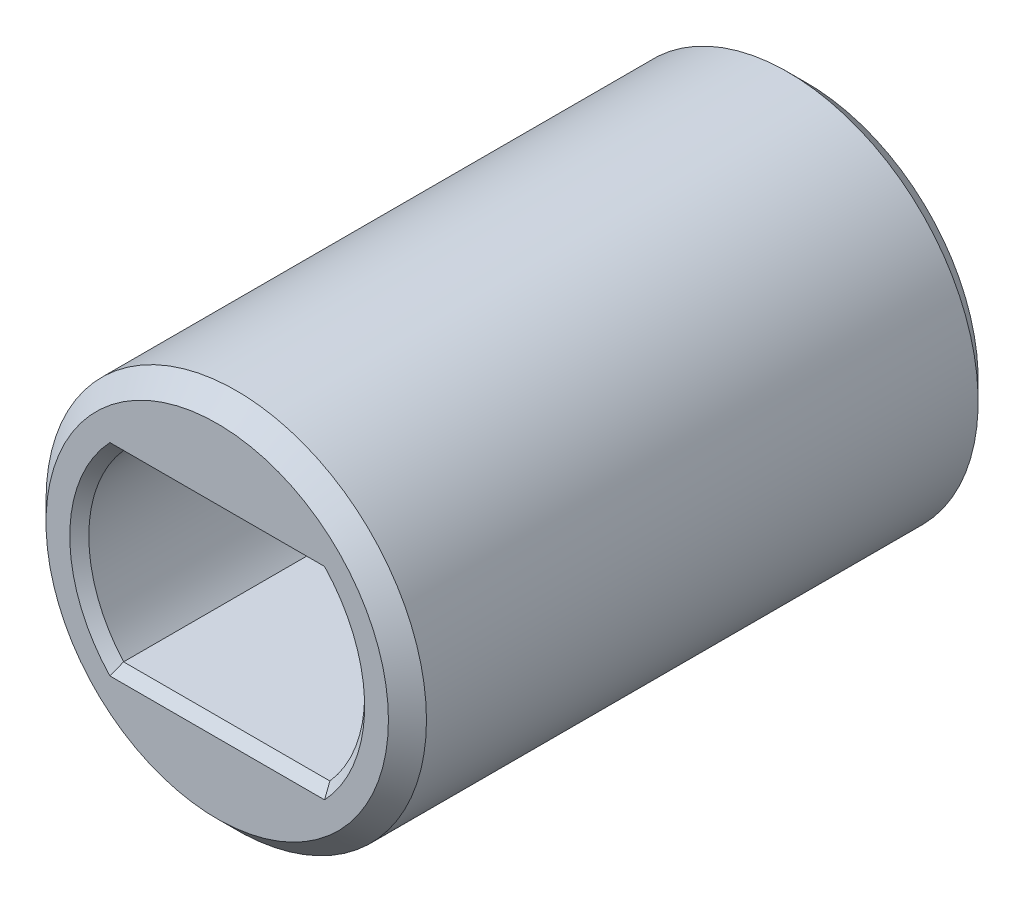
SolidWorks part; units mm, degrees
ref_plane "Přední rovina" through (0, 0, 0) normal (0, 0, 1) x (1, 0, 0)
ref_plane "Horní rovina" through (0, 0, 0) normal (0, 1, 0) x (1, 0, 0)
ref_plane "Pravá rovina" through (0, 0, 0) normal (1, 0, 0) x (0, 0, -1)
sketch "Skica1" plane through (0, 0, 0) normal (0, 0, 1) x (1, 0, 0)
  line L0 (-5.0761, 0) -> (4.8847, 0) construction
  line L1 (-2.169, 1.925) -> (2.169, 1.925)
  line L2 (-2.169, -1.925) -> (2.169, -1.925)
  line L3 (-5.9628, 5.3333) -> (-1.4907, 10.3333) construction
  line L4 (0, 4.24) -> (0, -1.5529) construction
  line L5 (5.9628, 5.3333) -> (1.4907, 10.3333) construction
  arc A0 (-2.169, 1.925) -> (-2.169, -1.925) centre (0, 0) ccw
  arc A1 (2.169, -1.925) -> (2.169, 1.925) centre (0, 0) ccw
  arc A2 (-5.9628, 5.3333) -> (5.9628, 5.3333) centre (0, 0) ccw construction
  arc A3 (1.4907, 10.3333) -> (-1.4907, 10.3333) centre (0, 9) ccw construction
  circle A4 centre (0, 0) radius 4
  dimension "D1" = 2.9
  dimension "D3" = 8
  dimension "D4" = 2
  dimension "D5" = 11
  dimension "D6" = 8
  dimension "D2" = 3.85
extrude "Přidat vysunutím1" add sketch "Skica1" along normal blind 8.4
sketch "Skica2" plane through (0, 0, 0) normal (0, 0, -1) x (-1, 0, 0)
  circle A1 centre (0, 0) radius 4
  circle A2 centre (0, 0) radius 4
  dimension "D1" = 0
extrude "Přidat vysunutím2" add sketch "Skica2" along normal blind 4
sketch "Skica3" plane through (0, 0, -4) normal (0, 0, -1) x (-1, 0, 0)
  circle A0 centre (0, 0) radius 2
  dimension "D1" = 4
extrude "Odebrat vysunutím1" cut sketch "Skica3" against normal blind 2
chamfer "Zkosení2" distance 0.2 angle 45 5 edges at (2.9, 0, 8.4) (0, -1.925, 8.4) (0, 1.925, 8.4) (-2.9, 0, 8.4) (-2, 0, -4)
chamfer "Zkosení3" distance 0.4 angle 45 2 edges at (-4, 0, -4) (4, 0, 8.4)
